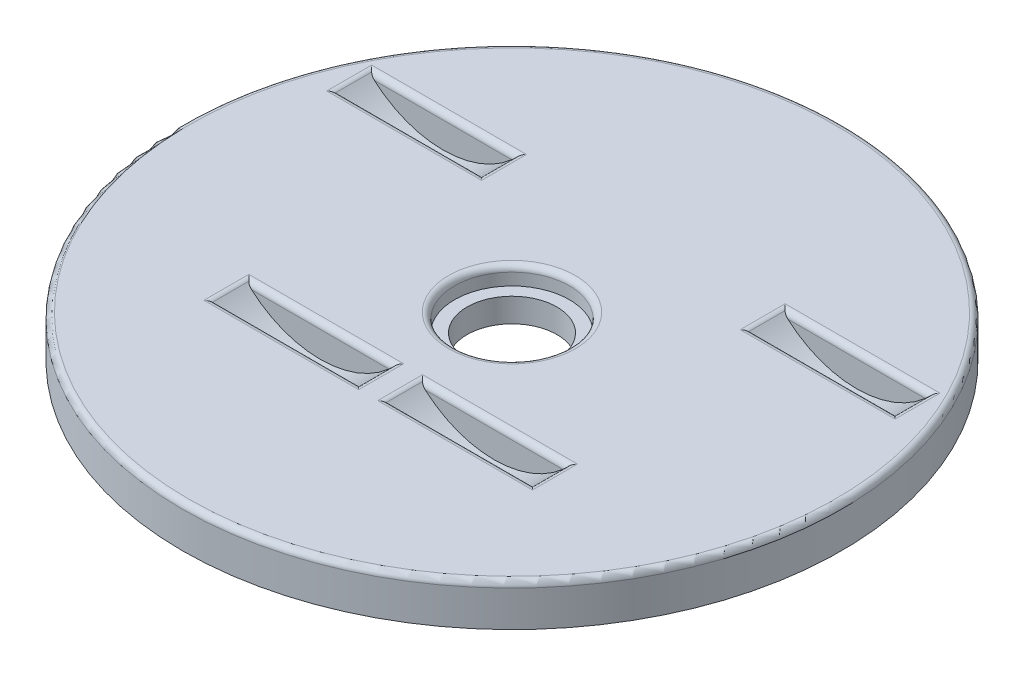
SolidWorks part; units mm, degrees
ref_plane "Front Plane" through (0, 0, 0) normal (0, 0, 1) x (1, 0, 0)
ref_plane "Top Plane" through (0, 0, 0) normal (0, 1, 0) x (1, 0, 0)
ref_plane "Right Plane" through (0, 0, 0) normal (1, 0, 0) x (0, 0, -1)
sketch "Sketch1" plane through (0, 0, 0) normal (0, 1, 0) x (1, 0, 0)
  circle A0 centre (0, 0) radius 13.97
  circle A1 centre (0, 0) radius 1.905
  dimension "D1" = 27.94
  dimension "D2" = 3.81
extrude "Extrude1" add sketch "Sketch1" along normal blind 1.778
ref_plane "Plane1" through (0, 0, 5.842) normal (0, 0, 1) x (1, 0, 0)
sketch "Sketch3" plane through (0, 0, 5.842) normal (0, 0, 1) x (1, 0, 0)
  line L0 (0, 0) -> (0, 3.612) construction
  line L1 (-13.97, 0) -> (13.97, 0) construction
  line L2 (-0.508, 1.778) -> (-6.858, 1.778)
  line L3 (13.97, 1.778) -> (-13.97, 1.778) construction
  line L4 (0.508, 1.778) -> (6.858, 1.778)
  arc A0 (-6.858, 1.778) -> (-0.508, 1.778) centre (-3.683, 4.826) ccw
  arc A1 (6.858, 1.778) -> (0.508, 1.778) centre (3.683, 4.826) cw
  dimension "D1" = 6.35
  dimension "D2" = 3.048
  dimension "D3" = 0.508
extrude "Cut-Extrude1" cut sketch "Sketch3" against normal blind 1.397
ref_plane "Plane2" through (0, 0, -5.842) normal (0, 0, 1) x (1, 0, 0)
sketch "Sketch4" plane through (0, 0, -5.842) normal (0, 0, 1) x (1, 0, 0)
  line L0 (-11.938, 1.778) -> (-5.588, 1.778)
  line L2 (5.588, 1.778) -> (11.938, 1.778)
  line L3 (0, 0) -> (0, 3.6097) construction
  line L4 (13.97, 1.778) -> (-13.97, 1.778) construction
  arc A0 (-11.938, 1.778) -> (-5.588, 1.778) centre (-8.763, 4.826) ccw
  arc A2 (11.938, 1.778) -> (5.588, 1.778) centre (8.763, 4.826) cw
  dimension "D4" = 3.048
  dimension "D1" = 6.35
  dimension "D2" = 2.032
extrude "Cut-Extrude2" cut sketch "Sketch4" along normal blind 1.397
sketch "Sketch5" plane through (0, 1.778, 0) normal (0, 1, 0) x (-1, 0, 0)
  circle A0 centre (0, 0) radius 2.4355
extrude "Cut-Extrude3" cut sketch "Sketch5" against normal blind 0.762
sketch "Sketch9" plane through (0, 0, 5.842) normal (0, 0, 1) x (1, 0, 0)
  line L2 (-0.508, 0) -> (-6.858, 0)
  line L3 (-0.508, 1.778) -> (-6.858, 1.778) construction
  line L4 (-13.97, 0) -> (13.97, 0) construction
  line L5 (0, 0) -> (0, 4.0216) construction
  line L6 (0.508, 0) -> (6.858, 0)
  arc A2 (-6.858, 0) -> (-0.508, 0) centre (-3.683, 3.048) ccw
  arc A3 (-6.858, 1.778) -> (-0.508, 1.778) centre (-3.683, 4.826) ccw construction
  arc A11 (6.858, 0) -> (0.508, 0) centre (3.683, 3.048) cw
extrude "Extrude2" add sketch "Sketch9" against normal up to surface (1.397 mm away)
sketch "Sketch10" plane through (0, 0, -5.842) normal (0, 0, 1) x (1, 0, 0)
  line L0 (5.588, 0) -> (11.938, 0)
  line L1 (-5.588, 0) -> (-11.938, 0)
  line L2 (-13.97, 0) -> (13.97, 0) construction
  line L4 (-5.588, 1.778) -> (-11.938, 1.778) construction
  line L5 (0, 0) -> (0, 4.2806) construction
  arc A0 (11.938, 0) -> (5.588, 0) centre (8.763, 3.048) cw
  arc A1 (-11.938, 0) -> (-5.588, 0) centre (-8.763, 3.048) ccw
  arc A2 (-11.938, 1.778) -> (-5.588, 1.778) centre (-8.763, 4.826) ccw construction
extrude "Extrude3" add sketch "Sketch10" along normal up to surface (1.397 mm away)
fillet "Fillet1" radius 0.254 18 edges at (0, 1.778, 2.4355) (0, 1.778, 13.97) (-8.763, 1.778, -5.842) (-11.938, 1.778, -5.1435) (-5.588, 1.778, -5.1435) (-8.763, 1.778, -4.445) (6.858, 1.778, 5.1435) (0.508, 1.778, 5.1435) (3.683, 1.778, 5.842) (3.683, 1.778, 4.445) (-3.683, 1.778, 5.842) (-6.858, 1.778, 5.1435) (-0.508, 1.778, 5.1435) (-3.683, 1.778, 4.445) (5.588, 1.778, -5.1435) (11.938, 1.778, -5.1435) (8.763, 1.778, -5.842) (8.763, 1.778, -4.445)
